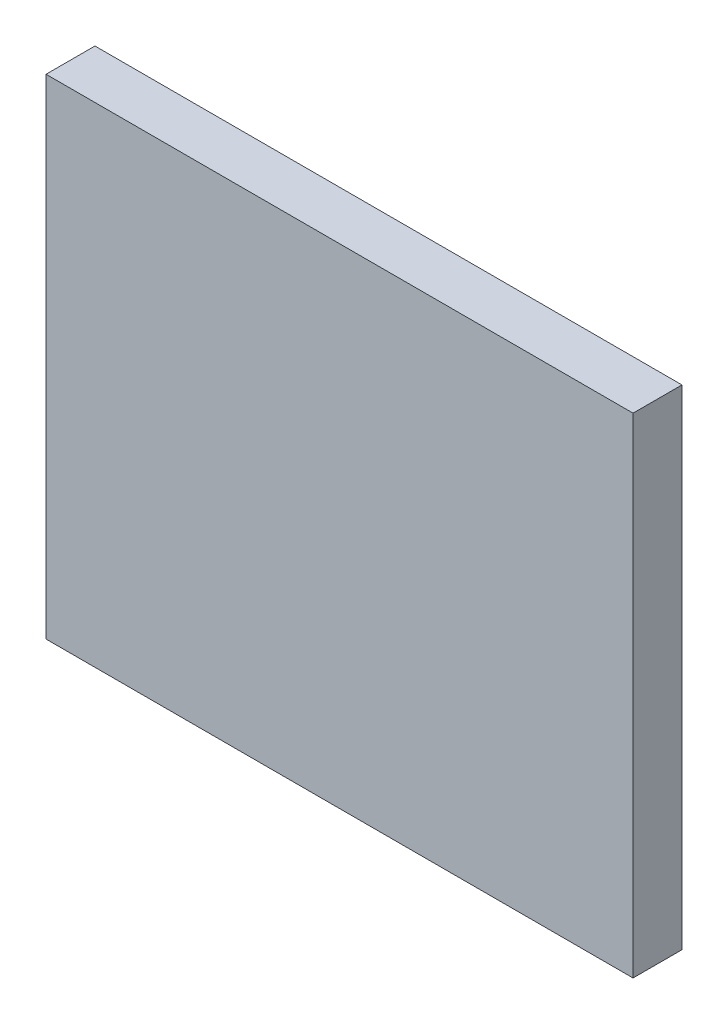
SolidWorks part; units mm, degrees
ref_plane "Face" through (0, 0, 0) normal (0, 0, 1) x (1, 0, 0)
ref_plane "Dessus" through (0, 0, 0) normal (0, 1, 0) x (1, 0, 0)
ref_plane "Droite" through (0, 0, 0) normal (1, 0, 0) x (0, 0, -1)
sketch "Esquisse1" plane through (0, 0, 0) normal (0, 0, 1) x (1, 0, 0)
  line L1 (0, 0) -> (60, 0)
  line L2 (0, 0) -> (0, -50)
  line L3 (0, -50) -> (60, -50)
  line L4 (60, 0) -> (60, -50)
  dimension "D1" = 60
  dimension "D2" = 50
extrude "Base-Extrusion" add sketch "Esquisse1" along normal blind 5
